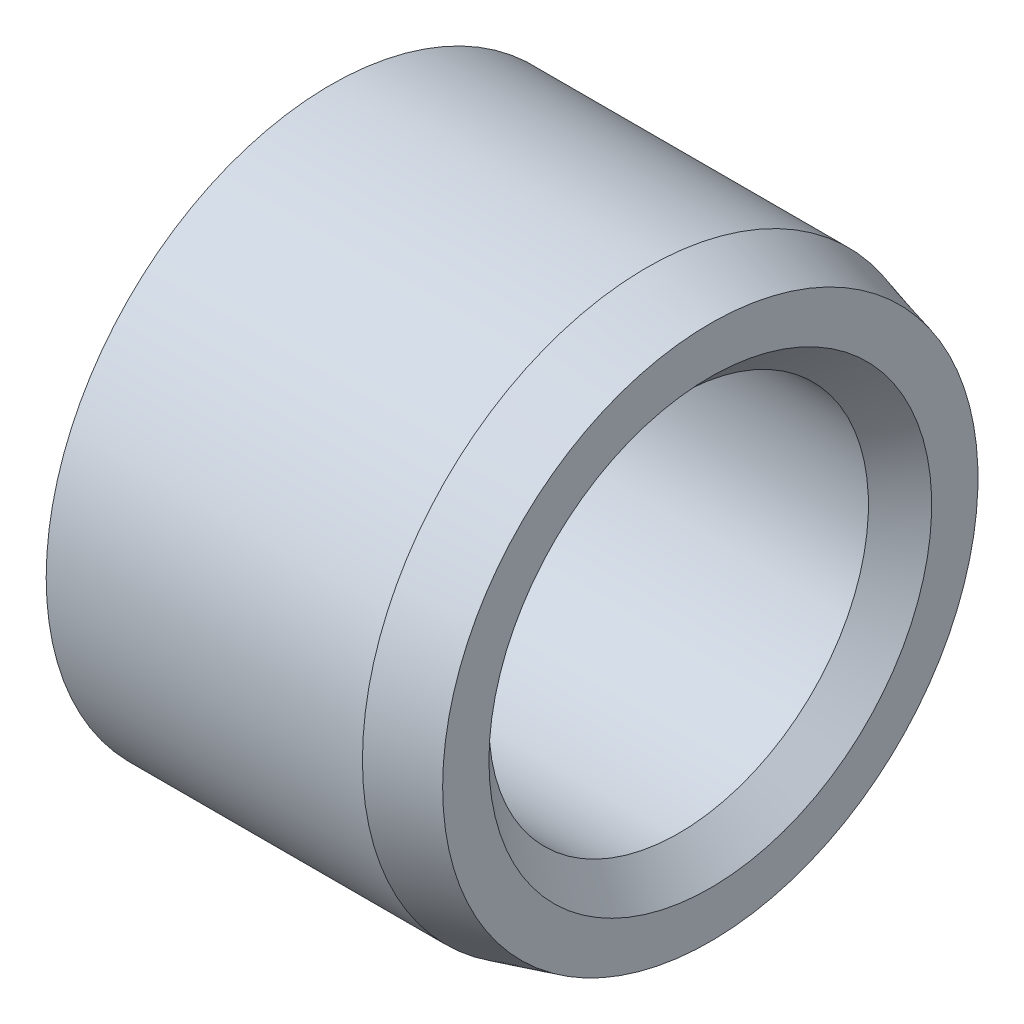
SolidWorks part; units mm, degrees
ref_plane "Plan de face" through (0, 0, 0) normal (0, 0, 1) x (1, 0, 0)
ref_plane "Plan de dessus" through (0, 0, 0) normal (0, 1, 0) x (1, 0, 0)
ref_plane "Plan de droite" through (0, 0, 0) normal (1, 0, 0) x (0, 0, -1)
ref_plane "Plan4" through (0, 0, 0) normal (0, 0, -1) x (-1, 0, 0)
sketch "Esquisse1" plane through (0, 0, 0) normal (0, 0, -1) x (-1, 0, 0)
  line L0 (-3, 2.116) -> (-3, 1.75)
  line L1 (-3, 1.75) -> (-2.75, 1.5)
  line L2 (-2.75, 1.5) -> (-0.3, 1.5)
  line L3 (-0.3, 1.5) -> (0, 1.8)
  line L4 (0, 1.8) -> (0, 2.25)
  line L5 (0, 2.25) -> (-2.5, 2.25)
  line L6 (-2.5, 2.25) -> (-3, 2.116)
  line L7 (-3, 0) -> (0, 0) construction
revolve "Révolution1" add sketch "Esquisse1" angle 360 about L7
